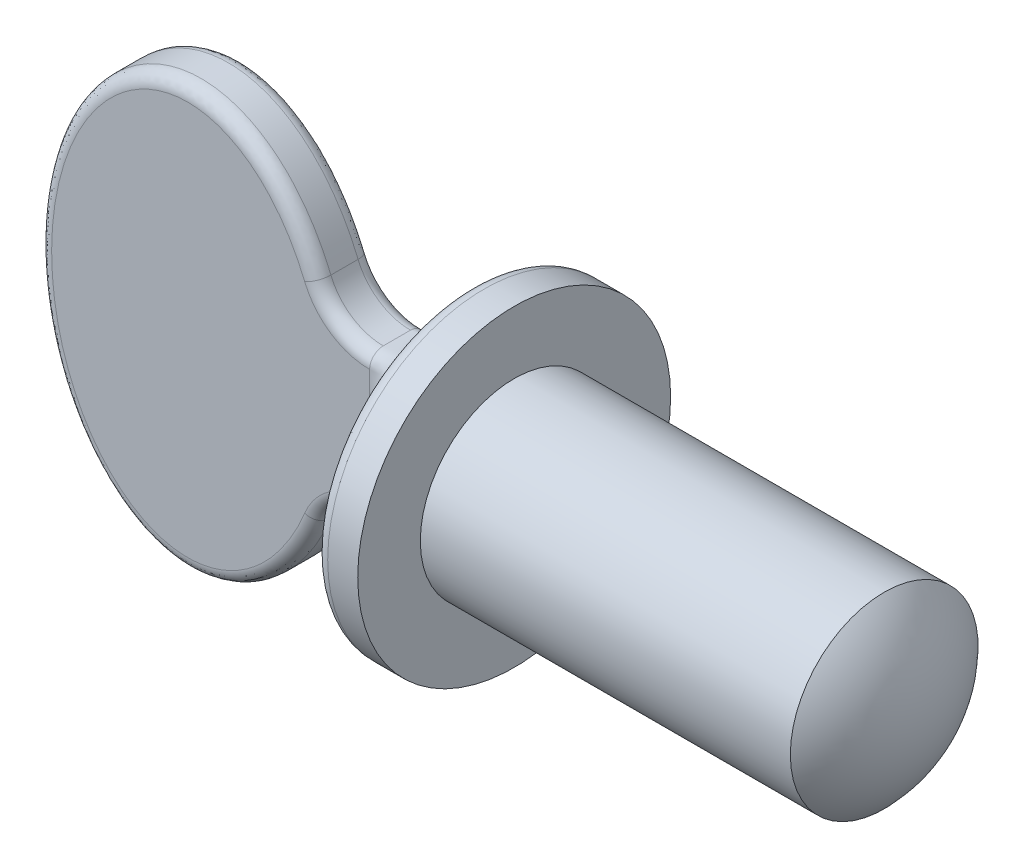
SolidWorks part; units mm, degrees
ref_plane "Front Plane" through (0, 0, 0) normal (0, 0, 1) x (1, 0, 0)
ref_plane "Top Plane" through (0, 0, 0) normal (0, 1, 0) x (1, 0, 0)
ref_plane "Right Plane" through (0, 0, 0) normal (1, 0, 0) x (0, 0, -1)
other "Configuration Table"
sketch "layout" plane through (0, 0, 0) normal (0, 0, 1) x (1, 0, 0)
  line L0 (0, 0) -> (13.208, 0) construction
  line L1 (5.588, 2.921) -> (5.588, -2.921)
  line L2 (3.3976, 1.3123) -> (4.8921, 1.3123) construction
  line L3 (5.588, 2.921) -> (4.7897, 2.921)
  line L4 (4.7897, 2.921) -> (4.7897, 3.2655) construction
  line L5 (4.2865, 1.706) -> (4.2865, 0)
  line L6 (4.2865, 1.706) -> (3.3355, 0.7551) construction
  line L7 (13.208, 1.7526) -> (13.208, 0)
  line L8 (3.3976, 1.3123) -> (3.3976, -1.3123)
  line L9 (13.208, 1.7526) -> (5.588, 1.7526)
  arc A0 (3.3976, 1.3123) -> (2.4197, 1.9685) centre (3.3976, 2.3692) cw
  arc A1 (4.7897, 2.921) -> (4.2865, 1.706) centre (3.0715, 2.921) cw
  arc A2 (3.3976, -1.3123) -> (2.4197, -1.9685) centre (3.3976, -2.3692) ccw
  ellipse E0 centre (0, 0) end of major axis (0, 3.937) minor radius 2.794 (2.4197, 1.9685) -> (2.4197, -1.9685) ccw
sketch "Sketch3" plane through (0, 0, 0) normal (0, 0, 1) x (1, 0, 0)
  line L0 (3.3976, 1.3123) -> (3.3976, -1.3123) construction
  line L1 (3.3976, 1.3123) -> (3.3976, -1.3123)
  arc A0 (3.3976, -1.3123) -> (2.4197, -1.9685) centre (3.3976, -2.3692) ccw construction
  arc A1 (2.4197, 1.9685) -> (3.3976, 1.3123) centre (3.3976, 2.3692) ccw construction
  arc A2 (3.3976, -1.3123) -> (2.4197, -1.9685) centre (3.3976, -2.3692) ccw
  arc A3 (2.4197, 1.9685) -> (3.3976, 1.3123) centre (3.3976, 2.3692) ccw
  ellipse E0 centre (0, 0) end of major axis (0, 3.937) minor radius 2.794 (2.4197, 1.9685) -> (2.4197, -1.9685) ccw construction
  ellipse E1 centre (0, 0) end of major axis (0, 3.937) minor radius 2.794 (2.4197, 1.9685) -> (2.4197, -1.9685) ccw
extrude "Extrude1" add sketch "Sketch3" along normal mid plane 1.016
fillet "Fillet1" radius 0.254 6 edges at (2.8088, 1.4916, -0.508) (2.8088, -1.4916, -0.508) (2.8088, 1.4916, 0.508) (2.8088, -1.4916, 0.508) (-2.794, 0, -0.508) (-2.794, 0, 0.508)
sketch "Sketch4" plane through (0, 0, 0) normal (0, 0, 1) x (1, 0, 0)
  line L1 (13.208, 1.7526) -> (5.588, 1.7526) construction
  line L2 (5.588, 2.921) -> (5.588, -2.921) construction
  line L3 (5.588, 2.921) -> (4.7897, 2.921) construction
  line L4 (4.2865, 1.706) -> (4.2865, 0) construction
  line L5 (13.208, 1.7526) -> (13.208, 0) construction
  line L6 (12.4966, 1.7526) -> (5.588, 1.7526)
  line L7 (5.588, 2.921) -> (5.588, 1.7526)
  line L8 (5.588, 2.921) -> (4.7897, 2.921)
  line L9 (4.2865, 1.706) -> (4.2865, 0)
  line L10 (0, 0) -> (16.8942, 0) construction
  line L11 (13.208, 0) -> (4.2865, 0)
  line L12 (13.208, 1.7526) -> (13.208, 0) construction
  arc A0 (4.2865, 1.706) -> (4.7897, 2.921) centre (3.0715, 2.921) ccw construction
  arc A1 (4.2865, 1.706) -> (4.7897, 2.921) centre (3.0715, 2.921) ccw
  arc A2 (13.208, 0) -> (12.4966, 1.7526) centre (10.6934, 0) ccw
revolve "Revolve1" add sketch "Sketch4" angle 360 about L10
loft "Loft1" add
fillet "Fillet2" radius 0.254 1 edges at (4.7897, 0, 2.921)
sketch "Sketch5" plane through (0, 0, 0) normal (0, 1, 0) x (1, 0, 0)
  line L0 (11.9511, 2.2981) -> (12.4966, 2.2981)
  line L1 (12.4966, 2.2981) -> (12.4966, 1.7526)
  line L2 (12.4966, 1.7526) -> (12.2239, 1.2802)
  line L3 (12.2239, 1.2802) -> (11.9511, 1.7526)
  line L5 (11.9511, 1.7526) -> (11.9511, 2.2981)
  line L7 (-3.6147, 0) -> (14.1406, 0) construction
revolve "Cut-Revolve10" [suppressed] cut sketch "Sketch5" angle 360 about L7
pattern_linear "LPattern10" [suppressed] count 8 along (1, 0, 0)
equation "\"D4@layout\" = \"Head Height@layout\" / 3 * 2"
equation "\"D5@layout\" = \"Head Width@layout\" / 3"
equation "\"D6@layout\" = \"Head Width@layout\" / 2"
equation "\"D7@layout\" = \"D5@layout\" * 1.3"
equation "\"D8@layout\" = \"D4@layout\"  / 7"
equation "\"D1@Fillet1\" = \"Head Thickness@Extrude1\" / 4"
equation "\"D1@Fillet2\" = \"D1@Fillet1\""
equation "\"D1@Sketch5\" = ( \"Base Screw Dia@layout\"- \"Minor Dia@Cosmetic Thread1\" )  / 2"
equation "\"D1@LPattern10\" = int((\"Length@layout\"-\"Ref@Sketch4\")/\"Advance@LPattern10\")"
